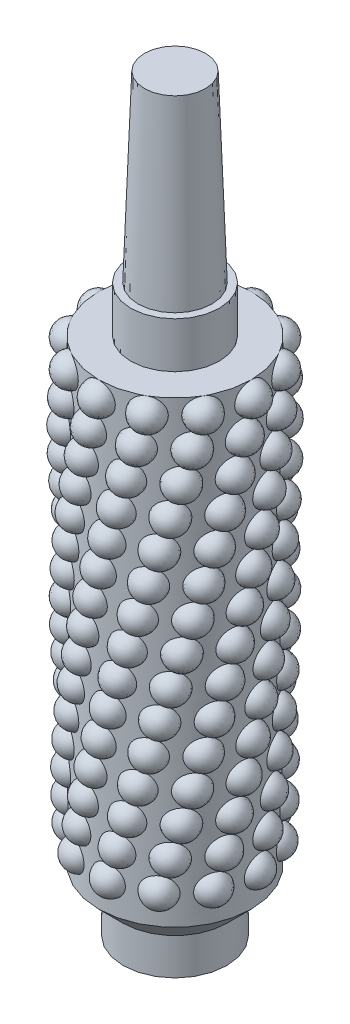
SolidWorks part; units mm, degrees
ref_plane "Front Plane" through (0, 0, 0) normal (0, 0, 1) x (1, 0, 0)
ref_plane "Top Plane" through (0, 0, 0) normal (0, 1, 0) x (1, 0, 0)
ref_plane "Right Plane" through (0, 0, 0) normal (1, 0, 0) x (0, 0, -1)
sketch "Sketch1" plane through (0, 0, 0) normal (0, 0, 1) x (1, 0, 0)
  line L0 (0, 0) -> (-10, 0)
  line L1 (-10, 0) -> (-12.0952, -60)
  line L2 (-12.0952, -60) -> (0, -60) construction
  line L3 (0, -60) -> (0, 0)
  line L4 (0, -60) -> (0, -75)
  line L5 (0, -75) -> (-14.5, -75)
  line L6 (-12.0952, -60) -> (-14.5, -60)
  line L7 (-14.5, -60) -> (-14.5, -75)
  point P3 (-10, -71.5126)
  dimension "D1" = 10
  dimension "D2" = 2
  dimension "D3" = 60
  dimension "D4" = 15
  dimension "D5" = 14.5
revolve "Revolve1" add sketch "Sketch1" angle 360 about L3
sketch "Sketch2" plane through (0, -75, 0) normal (0, -1, 0) x (1, 0, 0)
  circle A0 centre (0, 0) radius 25
  dimension "D1" = 50
extrude "Boss-Extrude1" add sketch "Sketch2" along normal blind 150
sketch "Sketch8" plane through (0, -75, 0) normal (0, 1, 0) x (1, 0, 0)
  circle A0 centre (0, 0) radius 25 construction
  circle A1 centre (0, 0) radius 25
curve "Helix/Spiral1"
sketch "Sketch3" plane through (0, 0, 0) normal (0, 0, 1) x (1, 0, 0)
  line L0 (25, -75) -> (25, -80) construction
  line L1 (25, -225) -> (25, -75) construction
  line L2 (25, -75) -> (25, -85)
  arc A0 (25, -75) -> (25, -85) centre (25, -80) cw
  point P6 (25, -63.0043)
  point P8 (25, -63.7631)
  dimension "D1" = 5
  dimension "D2" = 5
revolve "Revolve2" add sketch "Sketch3" angle 360 about L0
pattern_curve "CrvPattern1" of "Revolve2" parameters "D1"=15, "D3"=10, "D2"=1, "D4"=1
pattern_circular "CirPattern1" count 12 over 360 about axis through (0, 0, 0) along (0, 1, 0) of "Revolve2", "CrvPattern1"
sketch "Sketch9" plane through (0, -225, 0) normal (0, -1, 0) x (1, 0, 0)
  circle A0 centre (0, 0) radius 17
  circle A1 centre (0, 0) radius 5.35
  dimension "D1" = 34
  dimension "D2" = 10.7
extrude "Boss-Extrude2" add sketch "Sketch9" along normal blind 20
chamfer "Chamfer1" distance 8 angle 45 1 edges at (0, -225, -17)
